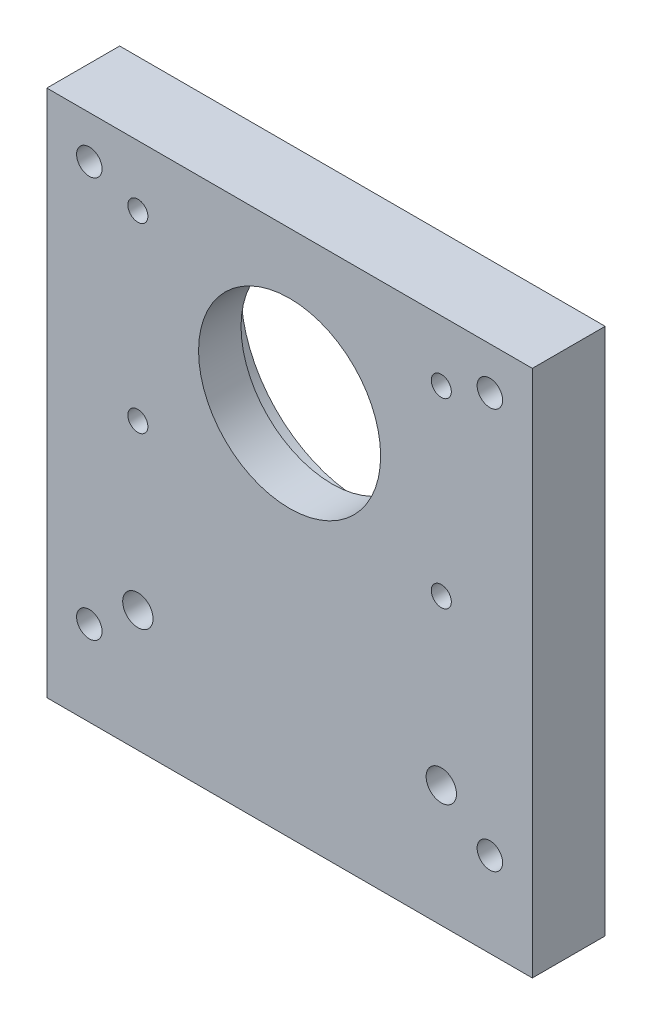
SolidWorks part; units mm, degrees
ref_plane "前视基准面" through (0, 0, 0) normal (0, 0, 1) x (1, 0, 0)
ref_plane "上视基准面" through (0, 0, 0) normal (0, 1, 0) x (1, 0, 0)
ref_plane "右视基准面" through (0, 0, 0) normal (1, 0, 0) x (0, 0, -1)
sketch "草图1" plane through (0, 0, 0) normal (0, 0, 1) x (1, 0, 0)
  line L0 (0, 0) -> (80, 0)
  line L1 (0, 87) -> (80, 87)
  line L2 (0, 87) -> (0, 0)
  line L3 (80, 87) -> (80, 0)
  circle A0 centre (65, 20) radius 2.5
  circle A1 centre (15, 20) radius 2.5
  circle A2 centre (40, 62) radius 15
  circle A3 centre (65, 47) radius 1.65
  circle A4 centre (65, 77) radius 1.65
  circle A5 centre (15, 77) radius 1.65
  circle A6 centre (15, 47) radius 1.65
  circle A7 centre (73, 14) radius 2.1
  circle A8 centre (73, 80) radius 2.1
  circle A9 centre (7, 14) radius 2.1
  circle A10 centre (7, 80) radius 2.1
extrude "凸台-拉伸1" add sketch "草图1" along normal blind 12
sketch "草图2" plane through (0, 0, 12) normal (0, 0, 1) x (1, 0, 0)
  circle A0 centre (40, 62) radius 20 construction
sketch "草图3" plane through (0, 0, 0) normal (0, 0, -1) x (-1, 0, 0)
  circle A0 centre (-40, 62) radius 20
extrude "切除-拉伸1" cut sketch "草图3" against normal blind 5
